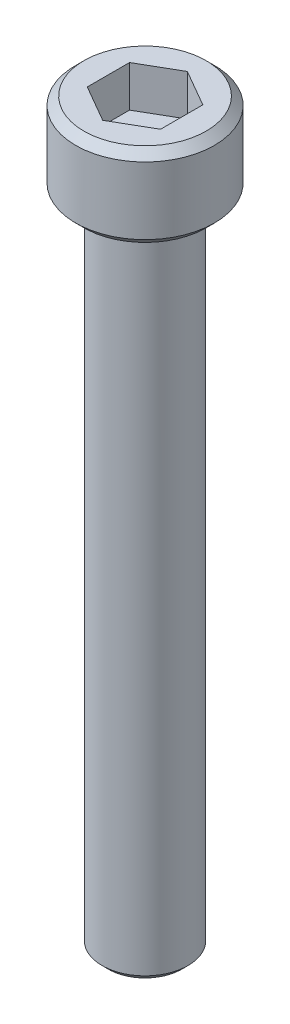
SolidWorks part; units mm, degrees
other "<SSA_SSA0832-1250ZC>-<Imported1>"
ref_plane "Front Plane" through (0, 0, 0) normal (0, 0, 1) x (1, 0, 0)
ref_plane "Top Plane" through (0, 0, 0) normal (0, 1, 0) x (1, 0, 0)
ref_plane "Right Plane" through (0, 0, 0) normal (1, 0, 0) x (0, 0, -1)
mirrored part "SSA_SSA0832-1250ZC_Mirrored"
